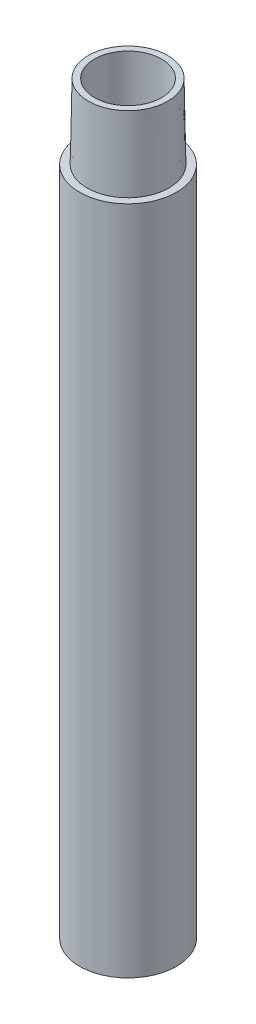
SolidWorks part; units mm, degrees
ref_plane "Plan de face" through (0, 0, 0) normal (0, 0, 1) x (1, 0, 0)
ref_plane "Plan de dessus" through (0, 0, 0) normal (0, 1, 0) x (1, 0, 0)
ref_plane "Plan de droite" through (0, 0, 0) normal (1, 0, 0) x (0, 0, -1)
sketch "Esquisse1" plane through (0, 0, 0) normal (0, 0, 1) x (1, 0, 0)
  line L0 (65, -919.506) -> (65, -19.506)
  line L1 (65, -19.506) -> (55, -19.506)
  line L2 (55, -19.506) -> (55, 80.494)
  line L3 (55, -919.506) -> (55, -29.506)
  line L4 (55, -29.506) -> (45, -29.506)
  line L5 (45, -29.506) -> (45, 80.494)
  line L10 (55, 80.494) -> (45, 80.494)
  line L12 (55, -919.506) -> (65, -919.506)
  dimension "D1" = 10
  dimension "D2" = 1000
  dimension "D3" = 65
  dimension "D4" = 100
  dimension "D5" = 10
ref_axis "Axe3" through (0, -969.506, 0) along (0, 1, 0)
revolve "Révolution9" add sketch "Esquisse1" angle 360 about axis through (0, -969.506, 0) along (0, 1, 0)
draft "Dépouille1" type of draft neutral plane draft angle 1 faces to draft 1 parameters "D1"=1
